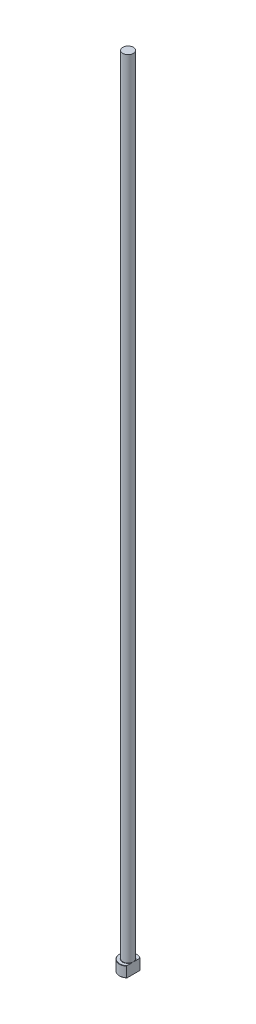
SolidWorks part; units mm, degrees
ref_plane "Front Plane" through (0, 0, 0) normal (0, 0, 1) x (1, 0, 0)
ref_plane "Top Plane" through (0, 0, 0) normal (0, 1, 0) x (1, 0, 0)
ref_plane "Right Plane" through (0, 0, 0) normal (1, 0, 0) x (0, 0, -1)
sketch "Sketch1" plane through (0, 0, 0) normal (0, 0, 1) x (1, 0, 0)
  line L0 (0, 259.9588) -> (0, -15.1925) construction
  line L1 (0, 0) -> (-6.5, 0)
  line L2 (-6.5, 0) -> (-6.5, 8)
  line L3 (-6.5, 8) -> (-4, 8)
  line L4 (-4, 8) -> (-4, 600)
  line L5 (-4, 600) -> (0, 600)
  line L6 (0, 600) -> (0, 0)
  dimension "L" = 600
  dimension "H" = 13
  dimension "T" = 8
  dimension "D" = 8
revolve "Revolve1" add sketch "Sketch1" angle 360 about L0
chamfer "Chamfer1" distance 0.2 angle 45 2 edges at (0, 8, 6.5) (0, 0, 6.5)
fillet "Fillet1" radius 0.2 1 edges at (0, 8, 4)
sketch "Sketch2" plane through (0, 0, 0) normal (0, 1, 0) x (1, 0, 0)
  line L0 (4, -5.1235) -> (4, 5.1235)
  circle A0 centre (0, 0) radius 6.5 construction
  arc A1 (4, -5.1235) -> (4, 5.1235) centre (0, 0) ccw
  circle A2 centre (0, 0) radius 4 construction
extrude "KEYED HEAD" cut sketch "Sketch2" along normal through all
